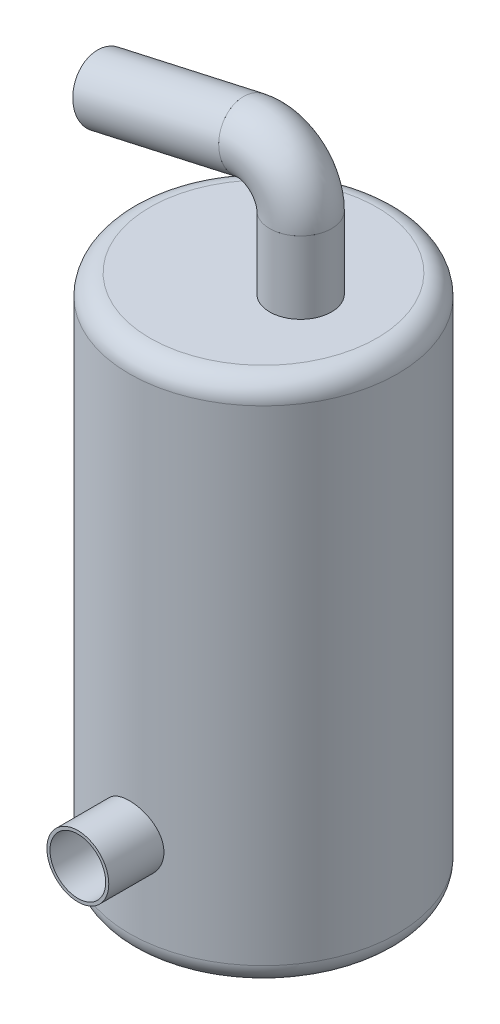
SolidWorks part; units mm, degrees
ref_plane "Plan de face" through (0, 0, 0) normal (0, 0, 1) x (1, 0, 0)
ref_plane "Plan de dessus" through (0, 0, 0) normal (0, 1, 0) x (1, 0, 0)
ref_plane "Plan de droite" through (0, 0, 0) normal (1, 0, 0) x (0, 0, -1)
sketch "Esquisse1" plane through (0, 0, 0) normal (0, 1, 0) x (1, 0, 0)
  circle A0 centre (0, 0) radius 65
  dimension "D1" = 130
extrude "Extrusion1" add sketch "Esquisse1" along normal blind 255
fillet "Congé1" radius 10 2 edges at (0, 255, 65) (0, 0, 65)
sketch "Esquisse2" plane through (0, 0, 0) normal (0, 0, 1) x (1, 0, 0)
  circle A0 centre (0, 50.8108) radius 13.5
  circle A1 centre (0, 50.8108) radius 15
  dimension "D1" = 27
  dimension "D2" = 30
extrude "Extrusion2" add sketch "Esquisse2" along normal blind 90
sketch "Esquisse3" plane through (0, 0, 0) normal (0, 0, 1) x (1, 0, 0)
  line L0 (18, 255) -> (18, 290)
  line L1 (55, 255) -> (-55, 255) construction
  line L2 (-6.3629, 309.5183) -> (-77.1168, 293.703)
  arc A0 (18, 290) -> (-6.3629, 309.5183) centre (-2, 290) ccw
  dimension "D2" = 20
  dimension "D1" = 35
  dimension "D3" = 72.5
  dimension "D4" = 47
  dimension "D5" = 77.4
other "Elément mécano-soudé1"
ref_plane "Plan1" through (18, 255, 0) normal (0, 1, 0) x (-1, 0, 0)
sketch "Esquisse11" plane through (18, 255, 0) normal (0, 1, 0) x (-1, 0, 0)
  line L0 (0, 15) -> (0, -15) construction
  line L1 (15, 0) -> (-15, 0) construction
  circle A0 centre (0, 0) radius 15
  circle A1 centre (0, 0) radius 13.5
  point P8 (0, 0)
  dimension "D1" = 27
  dimension "D2" = 30
